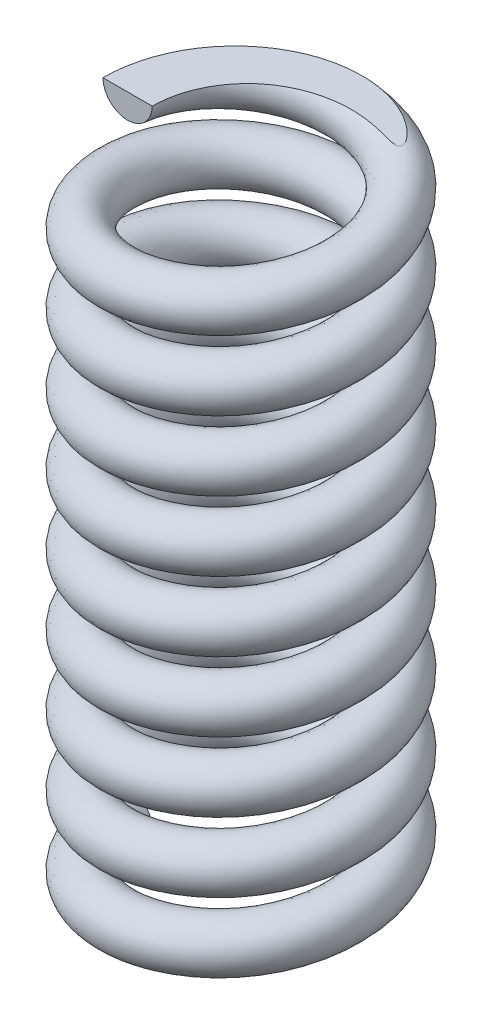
SolidWorks part; units mm, degrees
ref_plane "Front Plane" through (0, 0, 0) normal (0, 0, 1) x (1, 0, 0)
ref_plane "Top Plane" through (0, 0, 0) normal (0, 1, 0) x (1, 0, 0)
ref_plane "Right Plane" through (0, 0, 0) normal (1, 0, 0) x (0, 0, -1)
sketch "Sketch1" plane through (0, 0, 0) normal (0, 0, 1) x (1, 0, 0)
  line L0 (0, 0) -> (0, 63.5)
sketch "Sketch2" plane through (0, 0, 0) normal (0, 0, 1) x (1, 0, 0)
  circle A0 centre (-11.5, 0) radius 2.5
  dimension "D2" = 5
  dimension "D1" = 11.5
sweep "Sweep1" add profiles "Sketch2" path "Sketch1" parameters "D4"=3240
ref_plane "Plane2" through (0, 63.5, 0) normal (0, 1, 0) x (1, 0, 0)
other "SurfaceCut1"
other "SurfaceCut2"
